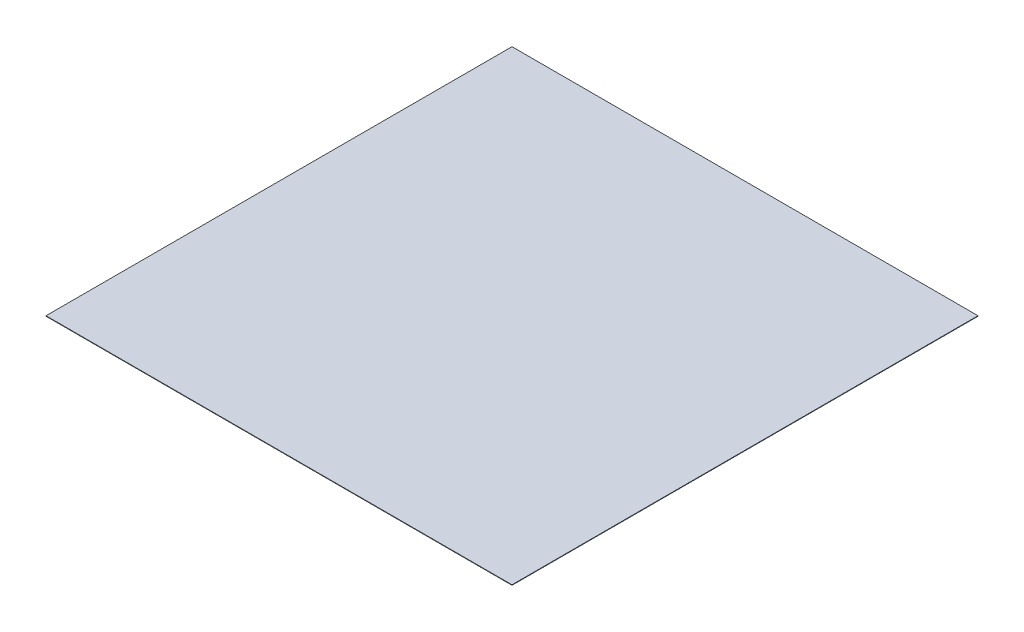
SolidWorks part; units mm, degrees
ref_plane "Front Plane" through (0, 0, 0) normal (0, 0, 1) x (1, 0, 0)
ref_plane "Top Plane" through (0, 0, 0) normal (0, 1, 0) x (1, 0, 0)
ref_plane "Right Plane" through (0, 0, 0) normal (1, 0, 0) x (0, 0, -1)
sketch "Sketch1" plane through (0, 0, 0) normal (0, 1, 0) x (1, 0, 0)
  line L1 (-71.2223, 25339.259) -> (25328.7777, 25339.259)
  line L2 (-71.2223, 25339.259) -> (-71.2223, -60.741)
  line L3 (-71.2223, -60.741) -> (25328.7777, -60.741)
  line L4 (25328.7777, 25339.259) -> (25328.7777, -60.741)
  dimension "D1" = 25400
  dimension "D2" = 25400
extrude "Extrude1" add sketch "Sketch1" along normal blind 25.4
